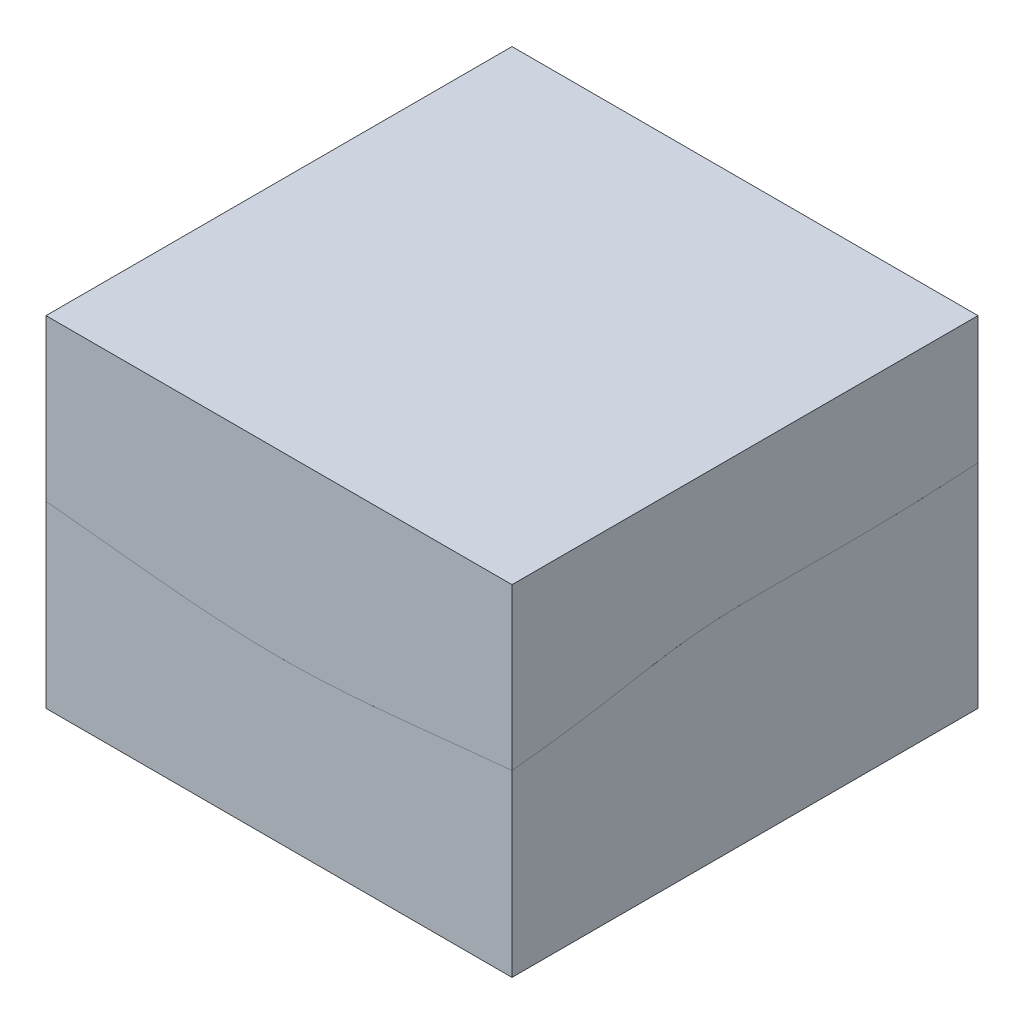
SolidWorks part; units mm, degrees
ref_plane "Front Plane" through (0, 0, 0) normal (0, 0, 1) x (1, 0, 0)
ref_plane "Top Plane" through (0, 0, 0) normal (0, 1, 0) x (1, 0, 0)
ref_plane "Right Plane" through (0, 0, 0) normal (1, 0, 0) x (0, 0, -1)
imported_body "Imported1"
other "Parting Line1"
other "Parting Surface1" parameters "D1"=177.8
sketch "Sketch1" plane through (0, 0, 0) normal (1, 0, 0) x (0, 0, -1)
  spline S0 degree 3 poles (-73.6334, 32.3058) (-73.6334, 28.2341) (-71.2868, 24.5249) (-67.6076, 22.7808) knots 0 0 0 0 0.5 0.5 0.5 0.5 construction
  point P0 (-73.6334, 32.3057)
ref_plane "Plane1" through (0, 32.3057, 0) normal (0, 1, 0) x (-1, 0, 0)
sketch "Sketch2" plane through (0, 32.3057, 0) normal (0, 1, 0) x (-1, 0, 0)
  line L0 (90.805, -90.805) -> (-90.805, 90.805) construction
  line L1 (90.805, -90.805) -> (-90.805, -90.805)
  line L2 (90.805, -90.805) -> (90.805, 90.805)
  line L3 (90.805, 90.805) -> (-90.805, 90.805)
  line L4 (-90.805, -90.805) -> (-90.805, 90.805)
  dimension "D1" = 181.61
  dimension "D2" = 181.61
other "Tooling Split1" parameters "D1"=69.85, "D2"=62.7126, "D3"=3
